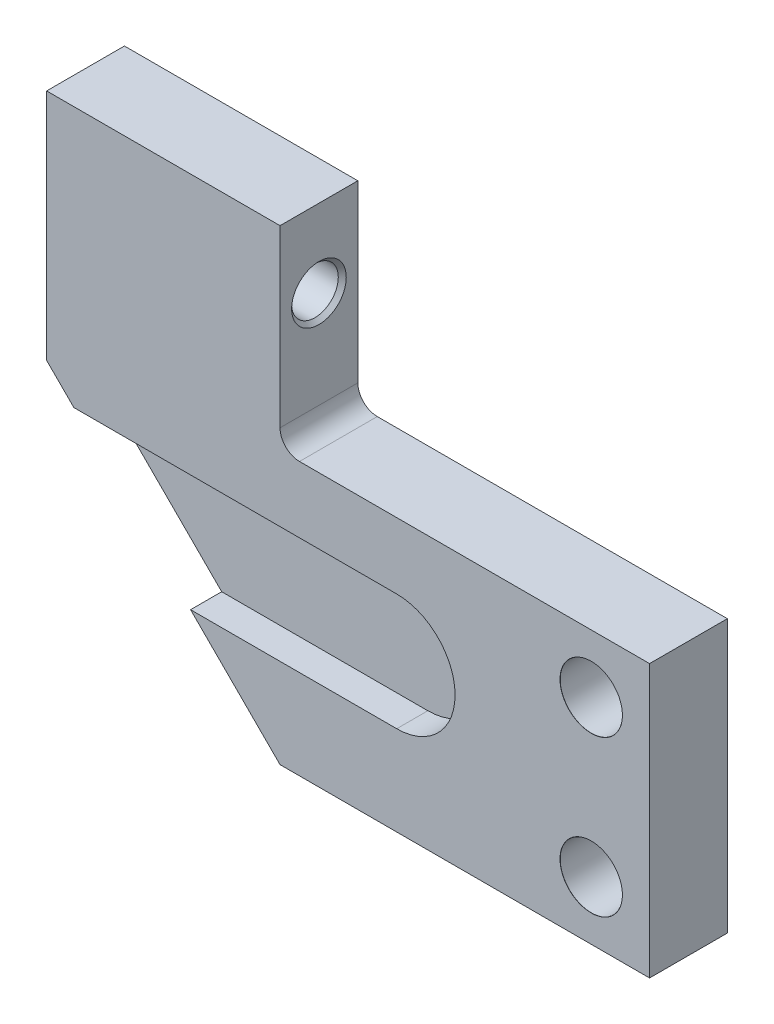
SolidWorks part; units mm, degrees
ref_plane "Ebene vorne" through (0, 0, 0) normal (0, 0, 1) x (1, 0, 0)
ref_plane "Ebene oben" through (0, 0, 0) normal (0, 1, 0) x (1, 0, 0)
ref_plane "Ebene rechts" through (0, 0, 0) normal (1, 0, 0) x (0, 0, -1)
sketch "Skizze1" plane through (0, 0, 0) normal (0, 0, 1) x (1, 0, 0)
  line L0 (0, 0) -> (0, 120)
  line L1 (0, 120) -> (60, 120)
  line L2 (60, 120) -> (60, 75)
  line L3 (60, 75) -> (65, 75) construction
  line L4 (65, 75) -> (65, 70) construction
  line L5 (0, 0) -> (155, 0)
  line L6 (155, 0) -> (155, 70)
  line L7 (155, 70) -> (65, 70)
  line L8 (0, 60) -> (60, 0)
  arc A0 (65, 70) -> (60, 75) centre (65, 75) cw
  dimension "D1" = 5
  dimension "D2" = 120
  dimension "D3" = 155
  dimension "D4" = 60
  dimension "D5" = 60
  dimension "D6" = 70
  dimension "D7" = 60
extrude "Aufsatz-Linear austragen1" add sketch "Skizze1" along normal blind 20 contours L7 A0 L2 L1 L0 L8 L5 L6
sketch "Skizze2" plane through (0, 0, 20) normal (0, 0, 1) x (1, 0, 0)
  line L0 (7, 53) -> (90, 53)
  line L1 (0, 60) -> (60, 0) construction
  line L2 (90, 23) -> (37, 23)
  line L3 (60, 0) -> (155, 0) construction
  line L4 (0, 60) -> (0, 120) construction
  line L12 (155, 70) -> (65, 70)
  line L13 (60, 75) -> (60, 120)
  line L14 (60, 120) -> (0, 120)
  line L15 (0, 120) -> (0, 60)
  line L16 (0, 60) -> (60, 0)
  line L17 (60, 0) -> (155, 0)
  line L18 (155, 0) -> (155, 70)
  line L23 (7, 53) -> (37, 23)
  arc A0 (90, 53) -> (90, 23) centre (90, 38) cw
  arc A2 (60, 75) -> (65, 70) centre (65, 75) ccw
  dimension "D1" = 23
  dimension "D2" = 30
  dimension "D3" = 90
  dimension "D4" = 0
extrude "Schnitt-Linear austragen1" cut sketch "Skizze2" against normal blind 8
hole_wizard "Ø16.0 (16) Durchmesser Bohrung6" positions "Skizze32" profile "Skizze31" hole size "Ø16.0" standard "DIN"
sketch "Skizze32" plane through (0, 0, 20) normal (0, 0, 1) x (1, 0, 0)
  line L0 (155, 70) -> (65, 70) construction
  line L1 (155, 0) -> (155, 70) construction
  line L2 (60, 0) -> (155, 0) construction
  point P0 (140, 55)
  point P1 (140, 15)
  dimension "D1" = 15
  dimension "D2" = 15
  dimension "D3" = 15
  dimension "D4" = 15
sketch "Skizze31" plane through (140, 55, 20) normal (1, 0, 0) x (0, -1, 0)
  line L0 (0, 0) -> (0, 20)
  line L1 (0, 20) -> (8.025, 20)
  line L2 (8, 19.975) -> (8, 0.025)
  line L3 (8, 0.025) -> (8.025, 0)
  line L5 (8.025, 0) -> (0, 0)
  line L6 (-8, 0.025) -> (-8.025, 0) construction
  line L7 (8.025, 20) -> (8, 19.975)
  line L8 (-8.025, 20) -> (-8, 19.975) construction
  line L11 (0, -6.35) -> (0, 107.95) construction
  dimension "Bohrerdurchmesser" = 16
  dimension "Bohrungstiefe" = 20
  dimension "Senkdurchmesser2 (Oben)" = 16.05
  dimension "Senkwinkel2 (Oben)" = 90
  dimension "Senkdurchmesser2 (Unten)" = 16.05
  dimension "Senkwinkel2 (Unten)" = 90
hole_wizard "M14 Gewindebohrung2" positions "Skizze36" profile "Skizze35" tap size "M14" standard "DIN"
sketch "Skizze36" plane through (60, 0, 0) normal (1, 0, 0) x (0, 0, -1)
  line L0 (-20, 120) -> (0, 120) construction
  line L1 (-20, 120) -> (-20, 75) construction
  point P0 (-10, 100)
  dimension "D1" = 20
  dimension "D2" = 10
sketch "Skizze35" plane through (60, 100, 10) normal (0, 1, 0) x (0, 0, -1)
  line L0 (0, 0) -> (0, 60)
  line L1 (0, 60) -> (7.025, 60)
  line L2 (6, 58.975) -> (6, 1.025)
  line L3 (6, 1.025) -> (7.025, 0)
  line L5 (7.025, 0) -> (0, 0)
  line L6 (-6, 1.025) -> (-7.025, 0) construction
  line L7 (7.025, 60) -> (6, 58.975)
  line L8 (-7.025, 60) -> (-6, 58.975) construction
  line L11 (0, -6.35) -> (0, 107.95) construction
  dimension "Bohrerdurchmesser" = 12
  dimension "Bohrungstiefe" = 60
  dimension "Senkdurchmesser (Oben)" = 14.05
  dimension "Senkwinkel (Oben)" = 90
  dimension "Senkdurchmesser (Unten)" = 14.05
  dimension "Senkwinkel (Unten)" = 90
